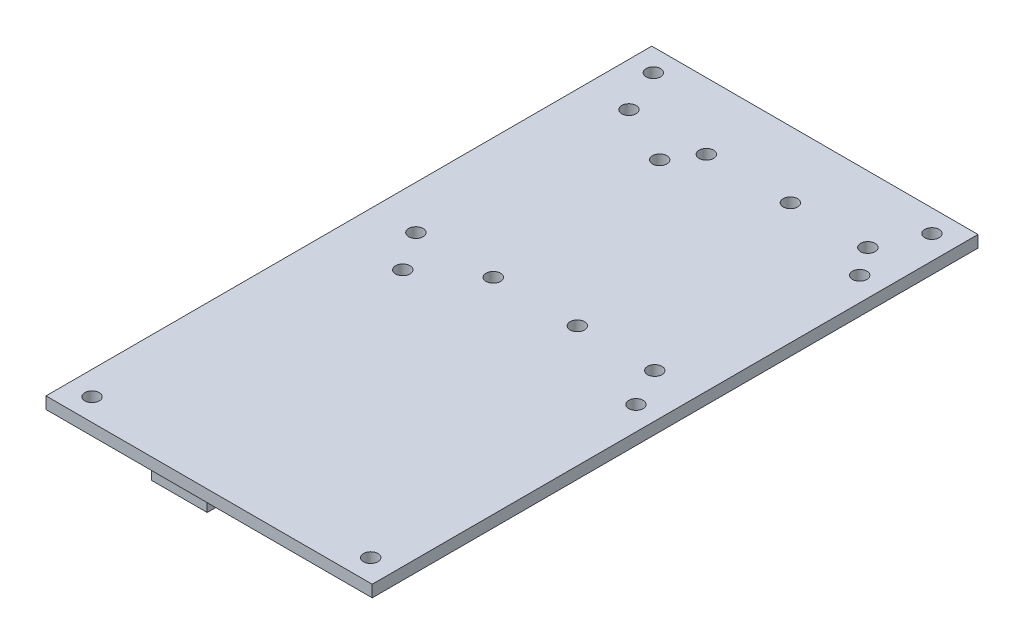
SolidWorks part; units mm, degrees
ref_plane "Front Plane" through (0, 0, 0) normal (0, 0, 1) x (1, 0, 0)
ref_plane "Top Plane" through (0, 0, 0) normal (0, 1, 0) x (1, 0, 0)
ref_plane "Right Plane" through (0, 0, 0) normal (1, 0, 0) x (0, 0, -1)
sketch "Sketch1" plane through (0, 0, 0) normal (0, 1, 0) x (1, 0, 0)
  line L1 (0, 0) -> (70.0024, 0)
  line L2 (0, 0) -> (0, 129.9972)
  line L3 (0, 129.9972) -> (70.0024, 129.9972)
  line L4 (70.0024, 0) -> (70.0024, 129.9972)
  dimension "D1" = 70.0024
  dimension "D2" = 129.9972
extrude "Boss-Extrude1" add sketch "Sketch1" along normal blind 2.54
sketch "Sketch2" plane through (0, 2.54, 0) normal (0, 1, 0) x (1, 0, 0)
  line L0 (5.1054, 125.222) -> (5.1054, 4.7752) construction
  line L1 (5.1054, 4.7752) -> (64.897, 4.7752) construction
  line L2 (64.897, 4.7752) -> (64.897, 125.222) construction
  line L3 (64.897, 125.222) -> (5.1054, 125.222) construction
  line L4 (0, 0) -> (70.0024, 0) construction
  line L5 (0, 129.9972) -> (0, 0) construction
  line L6 (70.0024, 0) -> (70.0024, 129.9972) construction
  line L7 (70.0024, 129.9972) -> (0, 129.9972) construction
  circle A0 centre (5.1054, 125.222) radius 1.55
  circle A1 centre (64.897, 125.222) radius 1.55
  circle A2 centre (64.897, 4.7752) radius 1.55
  circle A3 centre (5.1054, 4.7752) radius 1.55
  dimension "D1" = 3.1
  dimension "D2" = 3.1
  dimension "D3" = 3.1
  dimension "D4" = 3.1
  dimension "D5" = 4.7752
  dimension "D6" = 5.1054
  dimension "D7" = 5.1054
  dimension "D8" = 4.7752
extrude "Mounting" cut sketch "Sketch2" against normal through all
sketch "Sketch3" plane through (0, 2.54, 0) normal (0, 1, 0) x (1, 0, 0)
  line L0 (9.348, 70.0282) -> (25.9596, 70.0282) construction
  line L1 (25.9596, 70.0282) -> (43.9928, 70.0282) construction
  line L2 (43.9928, 70.0282) -> (60.6044, 70.0282) construction
  line L3 (60.6044, 70.0282) -> (60.6044, 115.7482) construction
  line L4 (60.6044, 115.7482) -> (43.9928, 115.7482) construction
  line L5 (43.9928, 115.7482) -> (25.9596, 115.7482) construction
  line L6 (25.9596, 115.7482) -> (9.348, 115.7482) construction
  line L7 (9.348, 115.7482) -> (9.348, 70.0282) construction
  line L8 (0, 129.9972) -> (0, 0) construction
  line L9 (70.0024, 0) -> (70.0024, 129.9972) construction
  line L10 (70.0024, 129.9972) -> (0, 129.9972) construction
  circle A0 centre (9.348, 115.7482) radius 1.55
  circle A1 centre (9.348, 70.0282) radius 1.55
  circle A2 centre (25.9596, 70.0282) radius 1.55
  circle A3 centre (25.9596, 115.7482) radius 1.55
  circle A4 centre (43.9928, 115.7482) radius 1.55
  circle A5 centre (60.6044, 115.7482) radius 1.55
  circle A6 centre (60.6044, 70.0282) radius 1.55
  circle A7 centre (43.9928, 70.0282) radius 1.55
  dimension "D1" = 3.1
  dimension "D2" = 3.1
  dimension "D3" = 3.1
  dimension "D4" = 3.1
  dimension "D5" = 3.1
  dimension "D6" = 3.1
  dimension "D7" = 3.1
  dimension "D8" = 3.1
  dimension "D9" = 9.348
  dimension "D10" = 9.398
  dimension "D11" = 14.249
  dimension "D12" = 45.72
  dimension "D13" = 16.6116
  dimension "D14" = 16.6116
  dimension "D15" = 16.6116
  dimension "D16" = 16.6116
extrude "Stratologger Mount" cut sketch "Sketch3" against normal through all
sketch "Sketch4" plane through (0, 2.54, 0) normal (0, 1, 0) x (1, 0, 0)
  line L0 (64.897, 109.7122) -> (64.897, 61.7062) construction
  line L1 (64.897, 61.7062) -> (14.859, 61.7062) construction
  line L2 (64.897, 109.7122) -> (21.971, 109.7122) construction
  line L3 (70.0024, 0) -> (70.0024, 129.9972) construction
  line L5 (70.0024, 129.9972) -> (0, 129.9972) construction
  circle A0 centre (21.971, 109.7122) radius 1.55
  circle A1 centre (64.897, 109.7122) radius 1.55
  circle A2 centre (64.897, 61.7062) radius 1.55
  circle A3 centre (14.859, 61.7062) radius 1.55
  dimension "D1" = 3.1
  dimension "D2" = 3.1
  dimension "D3" = 3.1
  dimension "D4" = 3.1
  dimension "D5" = 5.1054
  dimension "D6" = 48.006
  dimension "D7" = 20.285
  dimension "D8" = 42.926
  dimension "D9" = 50.038
extrude "Radio Mount" cut sketch "Sketch4" against normal through all
sketch "Sketch5" plane through (0, 0, 0) normal (0, -1, 0) x (-1, 0, 0)
  line L0 (0, 0) -> (-70.0024, 0) construction
  line L1 (-18.438, 4.16) -> (-30.438, 4.16)
  line L2 (-18.438, 4.16) -> (-18.438, 18.21)
  line L3 (-18.438, 18.21) -> (-30.438, 18.21)
  line L4 (-30.438, 4.16) -> (-30.438, 18.21)
  line L5 (-28.956, 113.9192) -> (-40.956, 113.9192)
  line L6 (-28.956, 113.9192) -> (-28.956, 127.9692)
  line L7 (-28.956, 127.9692) -> (-40.956, 127.9692)
  line L8 (-40.956, 113.9192) -> (-40.956, 127.9692)
  line L9 (0, 129.9972) -> (0, 0) construction
  line L11 (-70.0024, 129.9972) -> (0, 129.9972) construction
  point P12 (0, 0)
  dimension "D1" = 14.05
  dimension "D2" = 12
  dimension "D3" = 14.05
  dimension "D4" = 12
  dimension "D5" = 4.16
  dimension "D6" = 18.438
  dimension "D7" = 16.078
  dimension "D8" = 28.956
extrude "Boss-Extrude2" add sketch "Sketch5" along normal blind 6
equation "\"0.05905510.0590551in\"=0.1"
